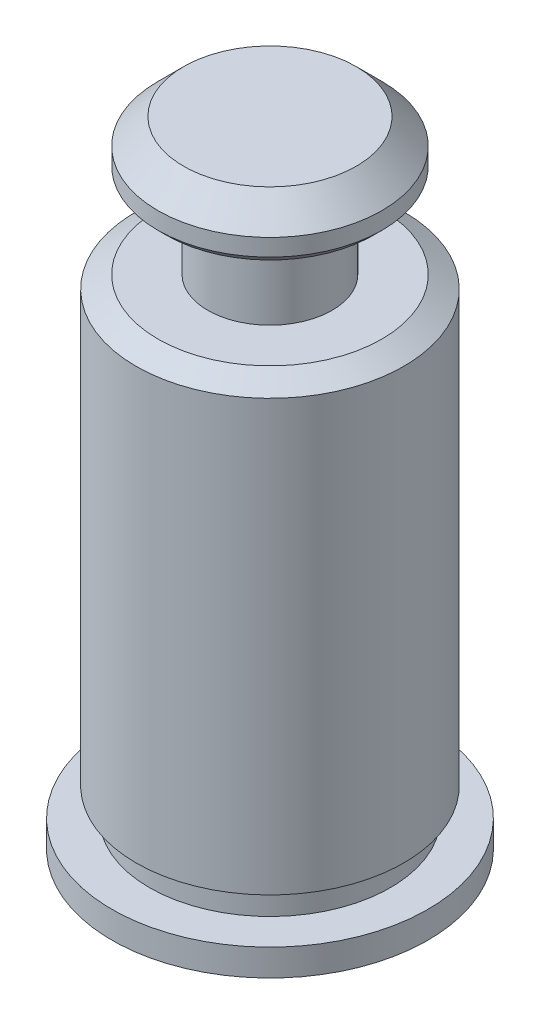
SolidWorks part; units mm, degrees
ref_plane "Plane1" through (0, 0, 0) normal (0, 0, 1) x (1, 0, 0)
ref_plane "Plane2" through (0, 0, 0) normal (0, 1, 0) x (1, 0, 0)
ref_plane "Plane3" through (0, 0, 0) normal (1, 0, 0) x (0, 0, -1)
sketch "BodySke" plane through (0, 0, 0) normal (0, 0, 1) x (1, 0, 0)
  line L0 (2.69, 0) -> (3.175, 0)
  line L1 (3.175, 0) -> (3.175, 0.538)
  line L2 (3.175, 0.538) -> (2.421, 0.538)
  line L3 (1.25, 10) -> (1.25, 11.72)
  line L4 (2.69, 1.1029) -> (2.421, 1.1029)
  line L5 (2.421, 1.1029) -> (2.421, 0.538)
  line L6 (2.69, 0.0051) -> (2.69, 0)
  line L7 (0, 0.0051) -> (2.69, 0.0051)
  line L8 (2.25, 10) -> (1.25, 10)
  line L9 (0, 0) -> (0, 15.24) construction
  line L10 (1.25, 11.72) -> (2.0783, 11.72)
  line L11 (2.69, 9.746) -> (2.69, 1.1029)
  line L12 (2.0783, 11.72) -> (2.25, 11.8917)
  line L13 (0, 0.0051) -> (0, 12.75)
  line L14 (2.25, 11.8917) -> (2.25, 12.235)
  line L15 (2.25, 12.235) -> (1.735, 12.75)
  line L16 (1.735, 12.75) -> (0, 12.75)
  line L17 (2.25, 10) -> (2.69, 9.746)
  dimension "D1" = 0.0051
  dimension "H_dia" = 6.35
  dimension "D2" = 45
  dimension "C_dia" = 5.38
  dimension "D3" = 45
  dimension "D4" = 30
  dimension "Clinching_ht" = 0.538
  dimension "Length" = 10
  dimension "Groove_wid" = 0.5649
  dimension "Groove_dia" = 4.842
  dimension "B_dia" = 4.5
  dimension "A_dia" = 2.5
  dimension "S_dim" = 1.72
  dimension "M_dim" = 2.75
  dimension "Top_chamfer_ht" = 0.515
  dimension "Under_chamfer_ht" = 0.1717
revolve "Body" add sketch "BodySke" angle 360 about L9
ref_plane "Plane4" through (0, -0.5486, 0) normal (0, 1, 0) x (-1, 0, 0)
equation "' \"Length@BodySke\" = 10"
equation "' \"A_dia@BodySke\" = 2.5"
equation "' \"B_dia@BodySke\" = 4.5"
equation "' \"C_dia@BodySke\" = 5.38"
equation "' \"S_dim@BodySke\" = 1.72"
equation "' \"M_dim@BodySke\" = 2.75"
equation "' \"H_dia@BodySke\" = 6.35"
equation "\"Top_chamfer_ht@BodySke\" = ( \"M_dim@BodySke\" - \"S_dim@BodySke\" ) * 0.5"
equation "\"Under_chamfer_ht@BodySke\" = \"Top_chamfer_ht@BodySke\" / 3"
equation "\"Clinching_ht@BodySke\" = \"C_dia@BodySke\" * 0.1"
equation "\"Groove_dia@BodySke\" = \"C_dia@BodySke\" * 0.9"
equation "\"Groove_wid@BodySke\" = \"Clinching_ht@BodySke\" * 1.05"
